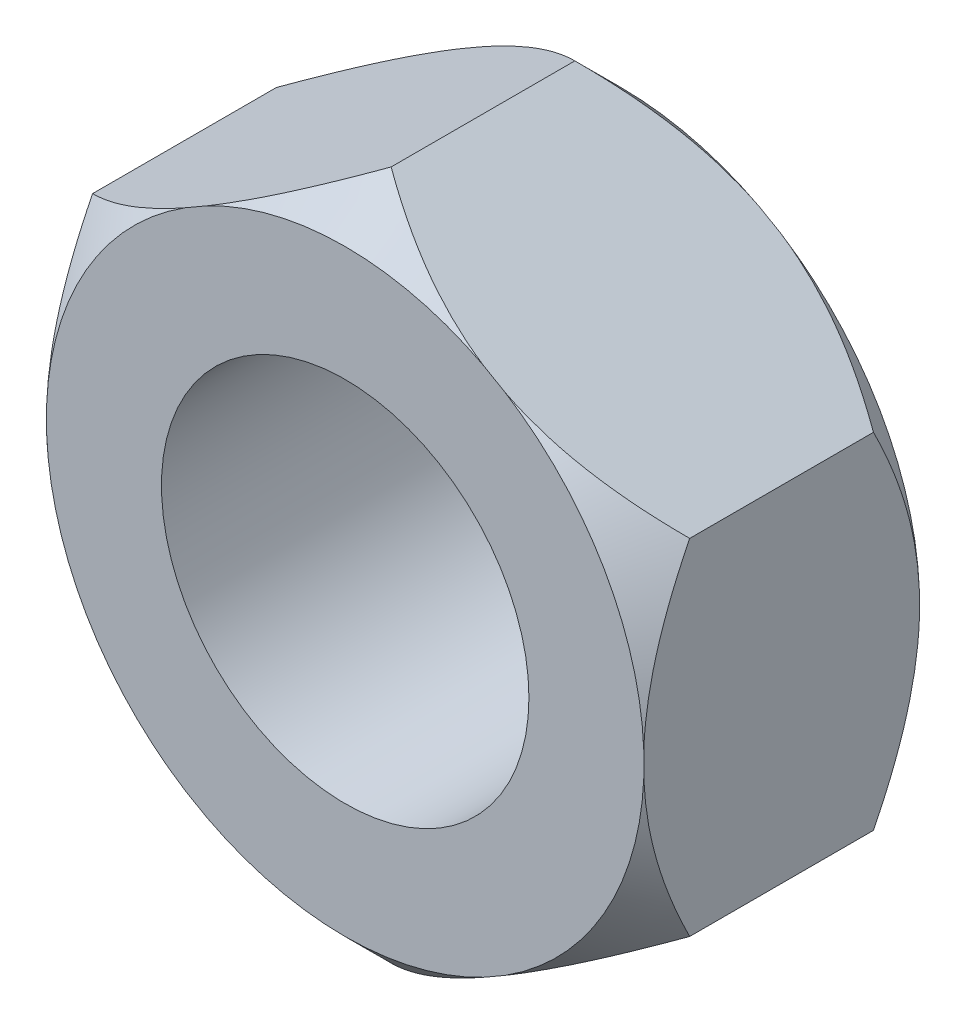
SolidWorks part; units mm, degrees
ref_plane "Face" through (0, 0, 0) normal (0, 0, 1) x (1, 0, 0)
ref_plane "Dessus" through (0, 0, 0) normal (0, 1, 0) x (1, 0, 0)
ref_plane "Droite" through (0, 0, 0) normal (1, 0, 0) x (0, 0, -1)
sketch "Esquisse1" plane through (0, 0, 0) normal (0, 0, 1) x (1, 0, 0)
  line L1 (0, 7.5056) -> (-6.5, 3.7528)
  line L2 (-6.5, 3.7528) -> (-6.5, -3.7528)
  line L3 (-6.5, -3.7528) -> (0, -7.5056)
  line L4 (0, -7.5056) -> (6.5, -3.7528)
  line L5 (6.5, -3.7528) -> (6.5, 3.7528)
  line L6 (6.5, 3.7528) -> (0, 7.5056)
  circle A0 centre (0, 0) radius 6.5 construction
  circle A1 centre (0, 0) radius 4
  dimension "D1" = 13
  dimension "D2" = 8
extrude "Base-Extrusion" add sketch "Esquisse1" against normal blind 6
sketch "Esquisse2" plane through (0, 0, 0) normal (1, 0, 0) x (0, 0, -1)
  line L0 (0, 7.5056) -> (1, 7.5056)
  line L1 (6, 7.5056) -> (0, 7.5056) construction
  line L2 (1, 7.5056) -> (0, 6.5056)
  line L3 (0, 3.7528) -> (0, 7.5056) construction
  line L4 (0, 6.5056) -> (0, 7.5056)
  line L5 (6, 7.5056) -> (5, 7.5056)
  line L6 (5, 7.5056) -> (6, 6.5056)
  line L7 (6, 6.5056) -> (6, 7.5056)
  line L9 (0, 0) -> (7.1553, 0) construction
  line L10 (6, 0) -> (0, 0) construction
  dimension "D1" = 1
revolve "Enlèvement de matière-Révolution1" cut sketch "Esquisse2" angle 360 about L9
